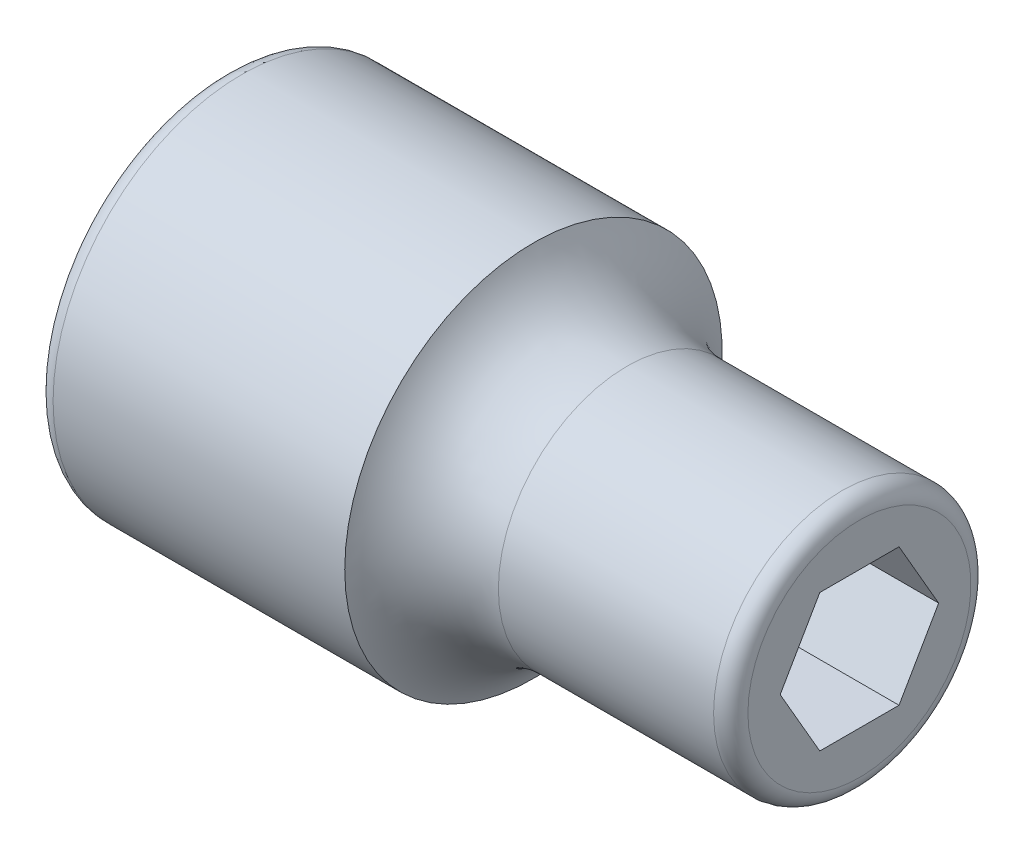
SolidWorks part; units mm, degrees
ref_plane "Plan1" through (0, 0, 0) normal (0, 0, 1) x (1, 0, 0)
ref_plane "Plan2" through (0, 0, 0) normal (0, 1, 0) x (1, 0, 0)
ref_plane "Plan3" through (0, 0, 0) normal (1, 0, 0) x (0, 0, -1)
sketch "Esquisse1" plane through (0, 0, 0) normal (0, 0, 1) x (1, 0, 0)
  line L0 (-26.5566, 6.5) -> (-28, 9)
  line L1 (-28, 9) -> (-28, 10)
  line L2 (-27, 11) -> (-10, 11)
  line L3 (-4.5456, 7.5) -> (8, 7.5)
  line L4 (9, 6.5) -> (9, 3.9)
  line L5 (0, 3) -> (-9, 3)
  line L6 (-10, 6.5) -> (-9, 3)
  line L7 (-10, 6.5) -> (-26.5566, 6.5)
  line L8 (0, -50) -> (0, 50) construction
  line L9 (0, 0) -> (23, 0) construction
  line L11 (0, 3) -> (0, 3.9)
  line L12 (0, 3.9) -> (9, 3.9)
  arc A0 (-4.5456, 7.5) -> (-10, 11) centre (-4.5456, 13.5) cw
  arc A1 (-27, 11) -> (-28, 10) centre (-27, 10) ccw
  arc A2 (9, 6.5) -> (8, 7.5) centre (8, 6.5) ccw
  dimension "D1" = 1
  dimension "D2" = 6
  dimension "D3" = 6
  dimension "D4" = 13
  dimension "D5" = 22
  dimension "D6" = 2.5
  dimension "D7" = 15
  dimension "D8" = 17
  dimension "D9" = 37
  dimension "D10" = 1
  dimension "D11" = 120
  dimension "D12" = 28
  dimension "D13" = 7.8
  dimension "D14" = 18
revolve "Base-Révolution" add sketch "Esquisse1" angle 360 about L9
sketch "Esquisse2" plane through (-28, 0, 0) normal (-1, 0, 0) x (0, 0, 1)
  line L1 (-5.5, 6.5) -> (5.5, 6.5)
  line L2 (-6.5, 5.5) -> (-6.5, -5.5)
  line L3 (-5.5, -6.5) -> (5.5, -6.5)
  line L4 (6.5, 5.5) -> (6.5, -5.5)
  circle A0 centre (0, 0) radius 6.5 construction
  arc A1 (6.5, 5.5) -> (5.5, 6.5) centre (5.5, 5.5) ccw
  arc A2 (5.5, -6.5) -> (6.5, -5.5) centre (5.5, -5.5) ccw
  arc A3 (-5.5, -6.5) -> (-6.5, -5.5) centre (-5.5, -5.5) cw
  arc A4 (-5.5, 6.5) -> (-6.5, 5.5) centre (-5.5, 5.5) ccw
  dimension "D1" = 1
extrude "Enlèv. mat.-Extru.1" cut sketch "Esquisse2" against normal blind 18
sketch "Esquisse3" plane through (9, 0, 0) normal (1, 0, 0) x (0, 0, -1)
  line L1 (-4.6188, 0) -> (-2.3094, -4)
  line L2 (-2.3094, -4) -> (2.3094, -4)
  line L3 (2.3094, -4) -> (4.6188, 0)
  line L4 (4.6188, 0) -> (2.3094, 4)
  line L5 (2.3094, 4) -> (-2.3094, 4)
  line L6 (-2.3094, 4) -> (-4.6188, 0)
  circle A0 centre (0, 0) radius 4 construction
  dimension "D1" = 8
extrude "Enlèv. mat.-Extru.2" cut sketch "Esquisse3" against normal blind 9
